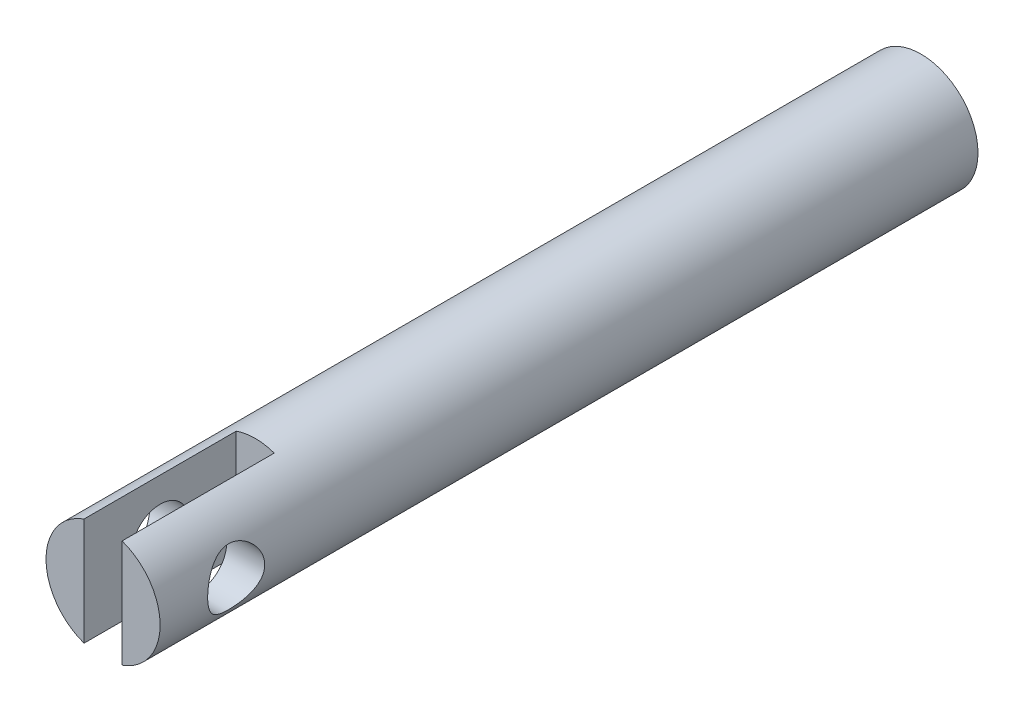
SolidWorks part; units mm, degrees
ref_plane "Front Plane" through (0, 0, 0) normal (0, 0, 1) x (1, 0, 0)
ref_plane "Top Plane" through (0, 0, 0) normal (0, 1, 0) x (1, 0, 0)
ref_plane "Right Plane" through (0, 0, 0) normal (1, 0, 0) x (0, 0, -1)
sketch "Sketch1" plane through (0, 0, 0) normal (0, 0, 1) x (1, 0, 0)
  circle A0 centre (0, 0) radius 4.7625
  dimension "D1" = 9.525
extrude "Extrude1" add sketch "Sketch1" along normal blind 68.2625
sketch "Sketch2" plane through (0, 0, 0) normal (0, 1, 0) x (1, 0, 0)
  line L0 (-4.7625, -68.2625) -> (4.7625, -68.2625) construction
  line L1 (-1.5875, -68.2625) -> (1.5875, -68.2625)
  line L2 (-1.5875, -68.2625) -> (-1.5875, -55.5625)
  line L3 (-1.5875, -55.5625) -> (1.5875, -55.5625)
  line L4 (1.5875, -68.2625) -> (1.5875, -55.5625)
  line L5 (0, 0) -> (0, -53.8976) construction
  dimension "D1" = 3.175
  dimension "D2" = 12.7
extrude "Cut-Extrude1" cut sketch "Sketch2" against normal through all and the other way through all
sketch "Sketch3" plane through (0, 0, 0) normal (1, 0, 0) x (0, 0, -1)
  line L0 (-68.2625, 4.4901) -> (-68.2625, -4.4901) construction
  circle A0 centre (-61.9125, 0) radius 2.3813
  dimension "D2" = 4.7625
  dimension "D1" = 6.35
extrude "Cut-Extrude2" cut sketch "Sketch3" against normal through all and the other way through all
hole_wizard "#10-32 Tapped Hole1" positions "Sketch5" profile "Sketch4" tap size "#10-32" standard "Ansi Inch"
sketch "Sketch5" plane through (0, 0, 0) normal (0, 0, -1) x (-1, 0, 0)
  point P0 (0, 0)
sketch "Sketch4" plane through (0, 0, 0) normal (1, 0, 0) x (0, 1, 0)
  line L0 (0, 0) -> (0, 16.2908)
  line L1 (0, 16.2908) -> (2.0193, 15.0774)
  line L2 (2.0193, 15.0774) -> (2.0193, 12.7)
  line L3 (2.0193, 12.7) -> (2.413, 12.7)
  line L4 (2.413, 12.7) -> (2.413, 0)
  line L5 (2.413, 0) -> (0, 0)
  line L10 (0, 16.2908) -> (-2.0193, 15.0774) construction
  line L11 (0, -6.35) -> (0, 107.95) construction
  dimension "Tap Drill Dia." = 4.0386
  dimension "Tap Drill Depth" = 15.0774
  dimension "Thread Major Dia." = 4.826
  dimension "Thread Depth" = 12.7
  dimension "Drill Angle" = 118
